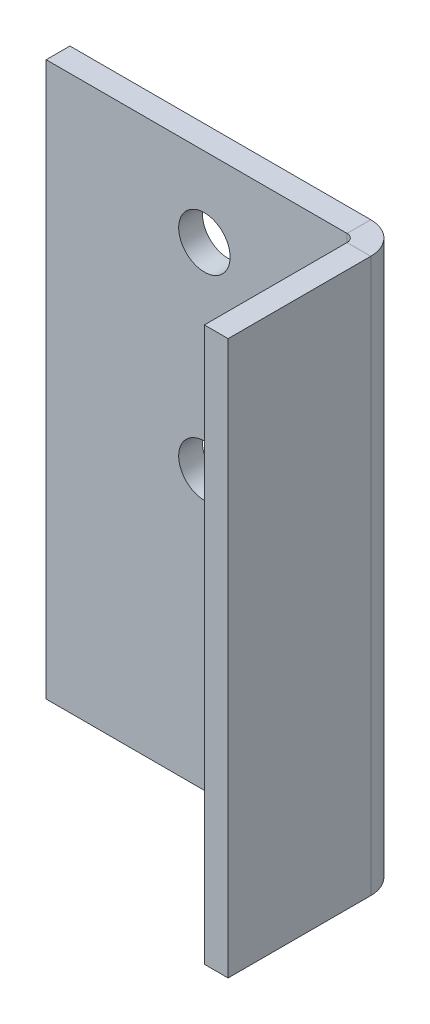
SolidWorks part; units mm, degrees
ref_plane "前视基准面" through (0, 0, 0) normal (0, 0, 1) x (1, 0, 0)
ref_plane "上视基准面" through (0, 0, 0) normal (0, 1, 0) x (1, 0, 0)
ref_plane "右视基准面" through (0, 0, 0) normal (1, 0, 0) x (0, 0, -1)
sketch "草图1" plane through (0, 0, 0) normal (0, 0, 1) x (1, 0, 0)
  line L1 (-120, 0) -> (0, 0)
  line L2 (-120, 0) -> (-120, 140)
  line L3 (-120, 140) -> (0, 140)
  line L4 (0, 0) -> (0, 140)
  circle A0 centre (-80, 70) radius 6.5
  circle A1 centre (-80, 120) radius 6.5
  dimension "D4" = 13
  dimension "D6" = 40
  dimension "D7" = 40
  dimension "D8" = 50
  dimension "D1" = 120
  dimension "D2" = 140
  dimension "D5" = 70
sheet metal parameters "钣金1" thickness 6 parameters "D1"=2
base flange "基体-法兰1" sketch "草图1" thickness 6 reverse thickness direction yes parameters "D1"=2
sketch "草图2" plane through (0, 0, 0) normal (0, 0, -1) x (-1, 0, 0)
  line L2 (40, 0) -> (40, 140)
  line L3 (40, 0) -> (40, 140)
  dimension "D1" = 40
sketched bend "绘制的折弯1" parameters "D1"=2
bend "草图折弯1" bend radius 2 bend angle 90 parameters "D5"=1
flat pattern "平板型式1"
sketch "折弯-线1" plane through (0, 0, 0) normal (0, 1, 0) x (-1, 0, 0)
bend of the flat pattern "展开-<草图折弯1>1"
